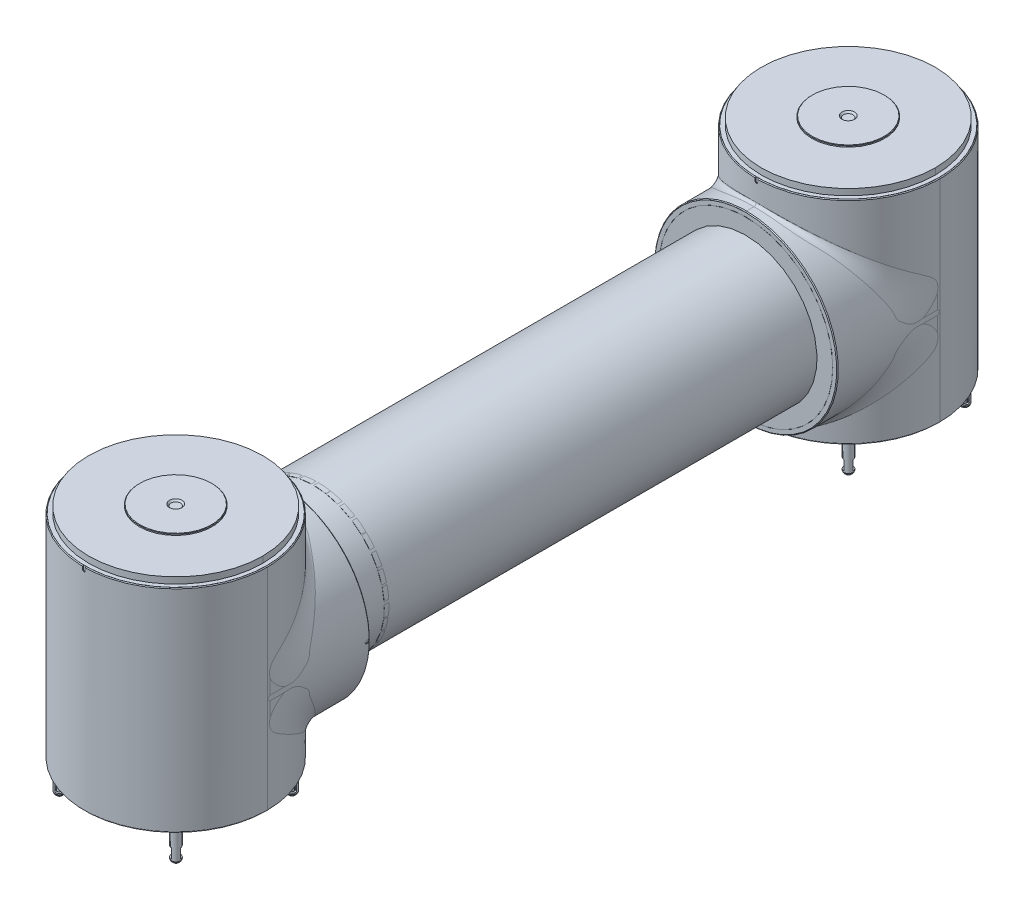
SolidWorks part; units mm, degrees
ref_plane "前视基准面" through (0, 0, 0) normal (0, 0, 1) x (1, 0, 0)
ref_plane "上视基准面" through (0, 0, 0) normal (0, 1, 0) x (1, 0, 0)
ref_plane "右视基准面" through (0, 0, 0) normal (1, 0, 0) x (0, 0, -1)
imported_body "25关节1-1-solid1"
imported_body "大臂4.0-1-1-solid1"
imported_body "大臂4.0-1-1-solid2"
imported_body "25关节1-2-solid1"
sketch "草图1" plane through (0, 0, 0) normal (0, 1, 0) x (1, 0, 0)
  circle A0 centre (46.218, 274.8535) radius 70.3121
  circle A1 centre (82.9114, 311.6991) radius 2.85
  circle A2 centre (9.3725, 311.547) radius 2.85
  circle A3 centre (9.5246, 238.008) radius 2.85
  circle A4 centre (83.0635, 238.1601) radius 2.85
  circle A5 centre (46.218, -150.1465) radius 69.6969
  circle A6 centre (82.9114, -113.3009) radius 2.85
  circle A7 centre (9.3725, -113.4531) radius 2.85
  circle A8 centre (83.0635, -186.8399) radius 2.85
  circle A9 centre (9.5246, -186.992) radius 2.85
extrude "切除-拉伸1" cut sketch "草图1" along normal blind 26.15
sketch "草图2" plane through (0, 0, -185.0535) normal (0, 0, 1) x (1, 0, 0)
  circle A1 centre (46.218, 87.249) radius 72.8533
  circle A2 centre (46.218, 87.249) radius 45
  dimension "D1" = 90
extrude "切除-拉伸2" cut sketch "草图2" against normal blind 25
sketch "草图3" plane through (0, 0, 60.3465) normal (0, 0, -1) x (-1, 0, 0)
  circle A0 centre (-46.218, 87.249) radius 77.3606
  circle A1 centre (-46.218, 87.249) radius 45
  dimension "D1" = 90
extrude "切除-拉伸3" cut sketch "草图3" against normal blind 25
